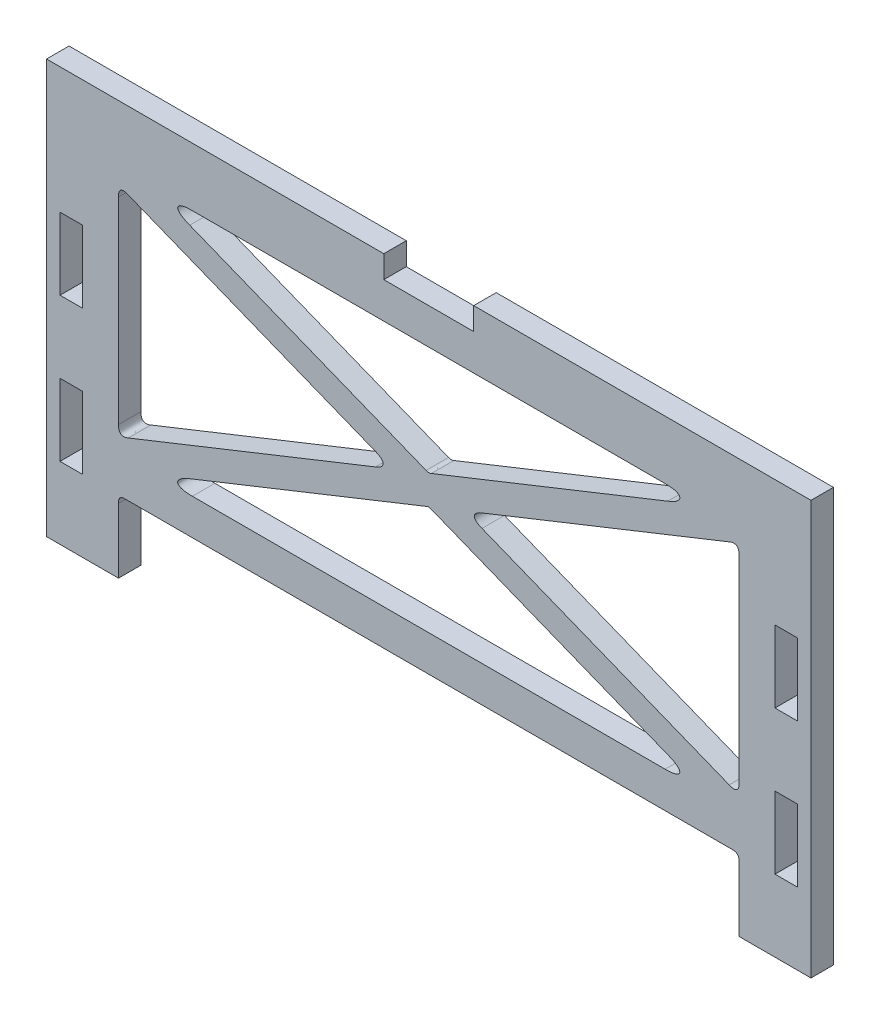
SolidWorks part; units mm, degrees
ref_plane "前视基准面" through (0, 0, 0) normal (0, 0, 1) x (1, 0, 0)
ref_plane "上视基准面" through (0, 0, 0) normal (0, 1, 0) x (1, 0, 0)
ref_plane "右视基准面" through (0, 0, 0) normal (1, 0, 0) x (0, 0, -1)
sketch "草图1" plane through (0, 0, 0) normal (0, 0, 1) x (1, 0, 0)
  line L1 (-42.5, 0) -> (42.5, 0)
  line L2 (-42.5, 0) -> (-42.5, 46)
  line L3 (-42.5, 46) -> (42.5, 46)
  line L4 (42.5, 0) -> (42.5, 46)
  dimension "D1" = 85
  dimension "D2" = 46
extrude "凸台-拉伸1" add sketch "草图1" along normal blind 2.5
sketch "草图2" plane through (0, 0, 2.5) normal (0, 0, 1) x (1, 0, 0)
  line L0 (0, 0) -> (0, 40.8847) construction
  line L1 (-42.5, 0) -> (42.5, 0) construction
  line L2 (42.5, 0) -> (42.5, 46) construction
  line L3 (38.5, 32) -> (41, 32)
  line L4 (38.5, 32) -> (38.5, 24)
  line L5 (38.5, 24) -> (41, 24)
  line L6 (41, 32) -> (41, 24)
  line L7 (38.5, 16) -> (41, 16)
  line L8 (38.5, 16) -> (38.5, 8)
  line L9 (38.5, 8) -> (41, 8)
  line L10 (41, 16) -> (41, 8)
  line L11 (-41, 16) -> (-41, 8)
  line L12 (-38.5, 8) -> (-41, 8)
  line L13 (-38.5, 16) -> (-38.5, 8)
  line L14 (-38.5, 16) -> (-41, 16)
  line L15 (-41, 32) -> (-41, 24)
  line L16 (-38.5, 24) -> (-41, 24)
  line L17 (-38.5, 32) -> (-38.5, 24)
  line L18 (-38.5, 32) -> (-41, 32)
  dimension "D1" = 2.5
  dimension "D2" = 1.5
  dimension "D3" = 8
  dimension "D4" = 8
  dimension "D5" = 8
  dimension "D6" = 8
extrude "切除-拉伸1" cut sketch "草图2" against normal up to surface (2.5 mm away)
sketch "草图3" plane through (0, 0, 2.5) normal (0, 0, 1) x (1, 0, 0)
  line L0 (0, 0) -> (0, 48.068) construction
  line L1 (-42.5, 0) -> (42.5, 0) construction
  line L3 (21, 0) -> (25, 0)
  line L4 (21, 0) -> (21, 10)
  line L6 (25, 0) -> (25, 10)
  arc A0 (25, 10) -> (21, 10) centre (23, 10) ccw
  dimension "D3" = 23
  dimension "D1" = 4
  dimension "D2" = 10
extrude "切除-拉伸2" [suppressed] cut sketch "草图3" against normal up to surface (2.5 mm away)
sketch "草图4" plane through (0, 0, 2.5) normal (0, 0, 1) x (1, 0, 0)
  line L0 (0, 46) -> (0, 29.7456) construction
  line L1 (42.5, 46) -> (-42.5, 46) construction
  line L3 (-5, 46) -> (5, 46)
  line L4 (-5, 46) -> (-5, 43.5)
  line L5 (-5, 43.5) -> (5, 43.5)
  line L6 (5, 46) -> (5, 43.5)
  dimension "D1" = 10
  dimension "D2" = 2.5
extrude "切除-拉伸3" cut sketch "草图4" against normal up to surface (2.5 mm away)
sketch "草图5" plane through (0, 0, 2.5) normal (0, 0, 1) x (1, 0, 0)
  line L0 (0, 0) -> (0, 49.7386) construction
  line L1 (-42.5, 0) -> (42.5, 0) construction
  line L2 (38.5, 16) -> (38.5, 8) construction
  line L3 (-34.5, 0) -> (34.5, 0)
  line L4 (-34.5, 0) -> (-34.5, 8)
  line L5 (-34.5, 8) -> (34.5, 8)
  line L6 (34.5, 0) -> (34.5, 8)
  line L7 (-5, 43.5) -> (5, 43.5) construction
  line L8 (-34.5, 39.5) -> (34.5, 39.5) construction
  line L9 (-34.5, 39.5) -> (-34.5, 12) construction
  line L10 (-34.5, 12) -> (34.5, 12) construction
  line L11 (34.5, 39.5) -> (34.5, 12) construction
  line L12 (-34.5, 39.5) -> (34.5, 12) construction
  line L13 (-34.5, 12) -> (34.5, 39.5) construction
  line L14 (-34.5, 37.8853) -> (-34.5, 13.6147)
  line L15 (-34.5, 13.6147) -> (-4.0515, 25.75)
  line L16 (-4.0515, 25.75) -> (-34.5, 37.8853)
  line L17 (-30.4485, 39.5) -> (0, 27.3647)
  line L18 (30.4485, 39.5) -> (0, 27.3647)
  line L19 (-30.4485, 39.5) -> (30.4485, 39.5)
  line L20 (4.0515, 25.75) -> (34.5, 37.8853)
  line L21 (34.5, 13.6147) -> (4.0515, 25.75)
  line L22 (34.5, 37.8853) -> (34.5, 13.6147)
  line L23 (-30.4485, 12) -> (0, 24.1353)
  line L24 (0, 24.1353) -> (30.4485, 12)
  line L25 (30.4485, 12) -> (-30.4485, 12)
  dimension "D1" = 4
  dimension "D2" = 8
  dimension "D3" = 4
  dimension "D4" = 4
  dimension "D5" = 1.5
  dimension "D6" = 1.5
  dimension "D7" = 1.5
  dimension "D8" = 1.5
extrude "切除-拉伸4" cut sketch "草图5" against normal up to surface (2.5 mm away)
fillet "圆角1" radius 0.8 14 edges at (0, 27.3647, 1.25) (-30.4485, 39.5, 1.25) (-34.5, 37.8853, 1.25) (30.4485, 39.5, 1.25) (34.5, 37.8853, 1.25) (4.0515, 25.75, 1.25) (-4.0515, 25.75, 1.25) (0, 24.1353, 1.25) (34.5, 13.6147, 1.25) (30.4485, 12, 1.25) (34.5, 8, 1.25) (-34.5, 8, 1.25) (-34.5, 13.6147, 1.25) (-30.4485, 12, 1.25)
